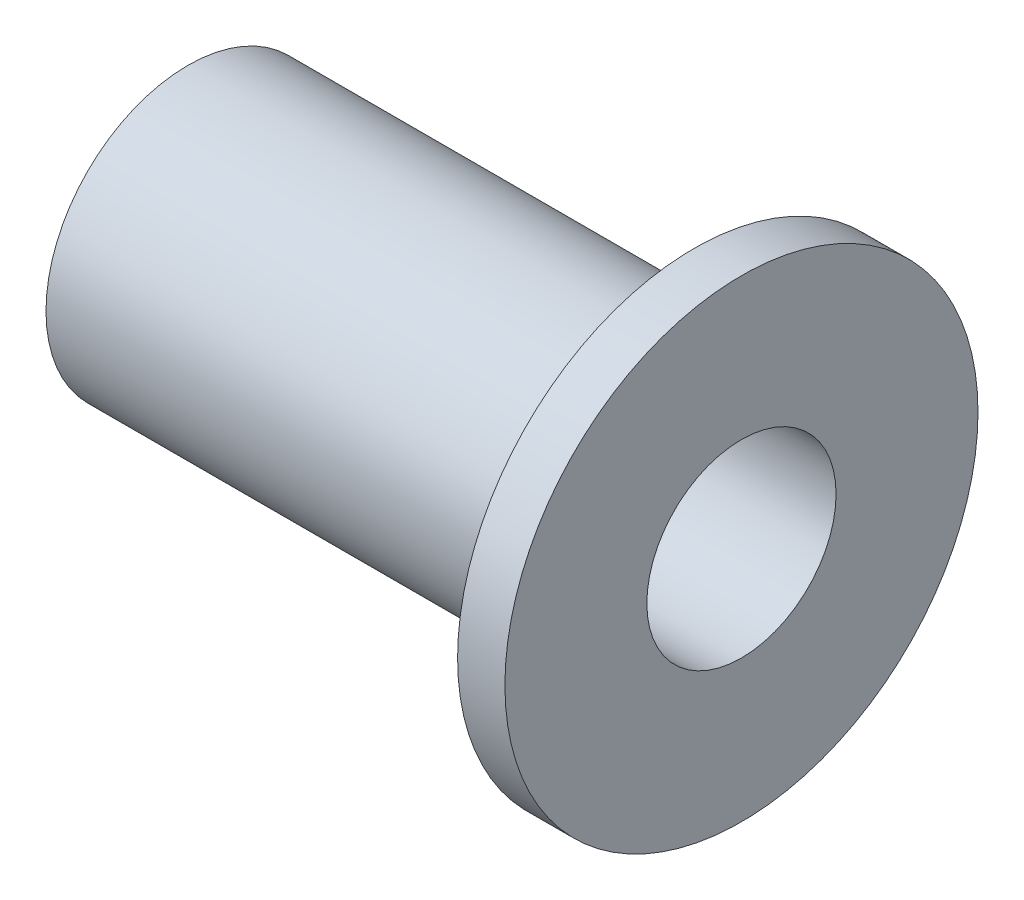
SolidWorks part; units mm, degrees
ref_plane "Face" through (0, 0, 0) normal (0, 0, 1) x (1, 0, 0)
ref_plane "Dessus" through (0, 0, 0) normal (0, 1, 0) x (1, 0, 0)
ref_plane "Droite" through (0, 0, 0) normal (1, 0, 0) x (0, 0, -1)
sketch "Esquisse1" plane through (0, 0, 0) normal (0, 0, 1) x (1, 0, 0)
  line L0 (-13.3048, 0) -> (20.3485, 0) construction
  line L1 (0, 2) -> (0, 3)
  line L2 (0, 3) -> (10.1, 3)
  line L3 (10.1, 3) -> (10.7, 5)
  line L4 (10.7, 5) -> (11.7, 5)
  line L5 (11.7, 5) -> (11.7, 2)
  line L6 (11.7, 2) -> (0, 2)
  dimension "D1" = 4
  dimension "D2" = 11.7
  dimension "D3" = 10
  dimension "D4" = 6
  dimension "D5" = 1
  dimension "D6" = 1.6
revolve "Base-Révolution" add sketch "Esquisse1" angle 360 about L0
